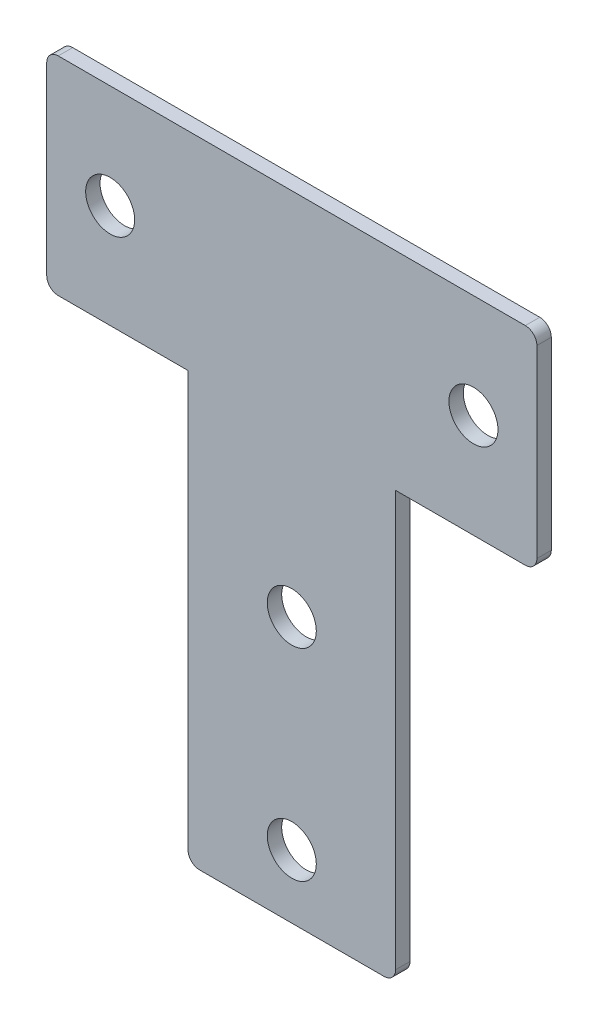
SolidWorks part; units mm, degrees
ref_plane "前视基准面" through (0, 0, 0) normal (0, 0, 1) x (1, 0, 0)
ref_plane "上视基准面" through (0, 0, 0) normal (0, 1, 0) x (1, 0, 0)
ref_plane "右视基准面" through (0, 0, 0) normal (1, 0, 0) x (0, 0, -1)
sketch "草图1" plane through (0, 0, 0) normal (0, 0, 1) x (1, 0, 0)
  line L0 (-61.2387, 0) -> (92.1098, 0) construction
  line L1 (0, -100.6664) -> (0, 162.0689) construction
  line L2 (18, -18) -> (42.5, -18)
  line L3 (-42.5, 18) -> (42.5, 18)
  line L4 (-42.5, 18) -> (-42.5, -18)
  line L5 (-42.5, -18) -> (-18, -18)
  line L6 (42.5, 18) -> (42.5, -18)
  line L7 (-42.5, 18) -> (42.5, -18) construction
  line L8 (-42.5, -18) -> (42.5, 18) construction
  line L10 (-18, -18) -> (-18, -92)
  line L11 (-18, -92) -> (18, -92)
  line L12 (18, -18) -> (18, -92)
  line L13 (-18, -18) -> (18, -92) construction
  line L14 (-18, -92) -> (18, -18) construction
  point P5 (0, 0)
  point P10 (0, -55)
  dimension "D1" = 85
  dimension "D2" = 36
  dimension "D3" = 36
  dimension "D4" = 74
extrude "凸台-拉伸1" add sketch "草图1" along normal mid plane 2.5
sketch "草图2" plane through (0, 0, 1.25) normal (0, 0, 1) x (1, 0, 0)
  circle A0 centre (31.5, 0) radius 4.25
  circle A1 centre (0, -81) radius 4.25
  circle A2 centre (0, -46) radius 4.25
  dimension "D1" = 8.5
  dimension "D3" = 8.5
  dimension "D2" = 11
  dimension "D4" = 11
  dimension "D5" = 35
extrude "切除-拉伸1" cut sketch "草图2" against normal blind 2.5
mirror "镜向1" about plane through (0, 0, 0) normal (1, 0, 0) of "切除-拉伸1"
fillet "圆角1" radius 2 6 edges at (18, -92, 0) (-18, -92, 0) (-42.5, -18, 0) (-42.5, 18, 0) (42.5, -18, 0) (42.5, 18, 0)
